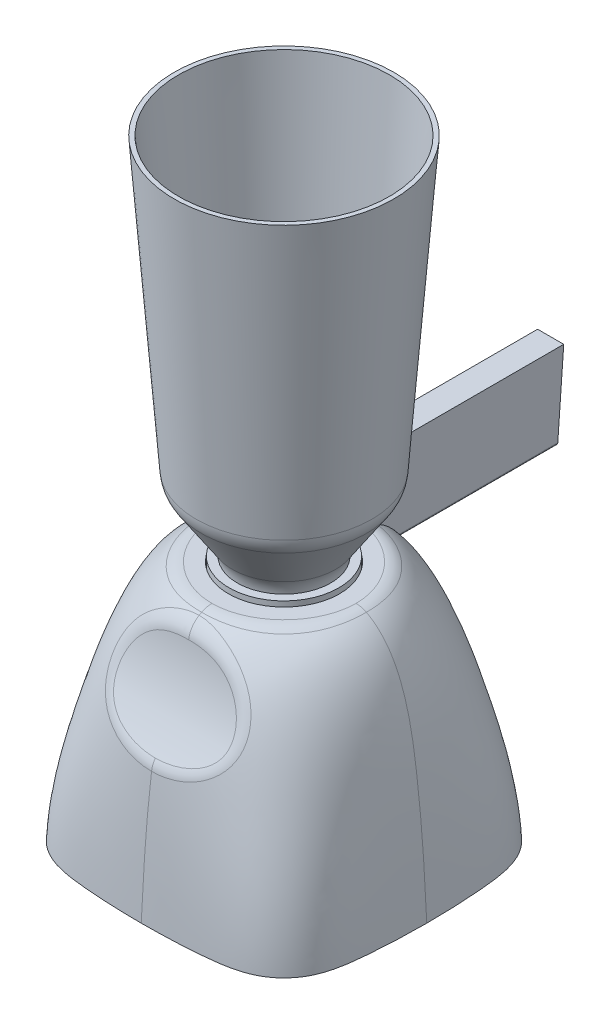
SolidWorks part; units mm, degrees
other "Cup"
other "Base"
ref_plane "Front Plane" through (0, 0, 0) normal (0, 0, 1) x (1, 0, 0)
ref_plane "Top Plane" through (0, 0, 0) normal (0, 1, 0) x (1, 0, 0)
ref_plane "Right Plane" through (0, 0, 0) normal (1, 0, 0) x (0, 0, -1)
ref_plane "Plane1" through (0, 139.7, 0) normal (0, 1, 0) x (1, 0, 0)
sketch "Sketch1" plane through (0, 0, 0) normal (0, 1, 0) x (1, 0, 0)
  line L0 (-74.93, 74.93) -> (74.93, -74.93) construction
  line L1 (-74.93, -74.93) -> (74.93, -74.93) construction
  line L2 (-74.93, -74.93) -> (-74.93, 74.93) construction
  line L3 (-74.93, 74.93) -> (74.93, 74.93) construction
  line L4 (74.93, -74.93) -> (74.93, 74.93) construction
  line L5 (-74.93, 0) -> (74.93, 0) construction
  line L6 (0, 74.93) -> (0, -74.93) construction
  line L7 (11.8724, -82.55) -> (-8.3162, -82.55) construction
  line L8 (82.55, 0.0047) -> (82.55, -0.4308) construction
  spline S0 degree 3 poles (0, -82.55) (11.2435, -82.55) (32.3228, -81.7522) (59.7035, -78.1331) (78.1331, -59.7035) (81.7522, -32.3225) (82.55, -11.2441) (82.55, 0) knots 0 0 0 0 0.238626 0.447515 0.552485 0.761374 1 1 1 1
  point P6 (-34.036, 81.0925)
  point P9 (-34.036, -81.0925)
  point P10 (-62.865, 73.4617)
  point P11 (-73.4617, 62.865)
  point P12 (62.865, 73.4617)
  point P13 (73.4617, 62.865)
  point P14 (73.4617, -62.865)
  point P15 (62.865, -73.4617)
  point P16 (-62.865, -73.4617)
  point P17 (-73.4617, -62.865)
  point P18 (82.55, 0)
  point P19 (0, 82.55)
  point P20 (-82.55, 0)
  point P21 (0, -82.55)
  point P22 (-81.0925, 34.036)
  point P23 (-81.0925, -34.036)
  point P24 (81.0925, 34.036)
  point P25 (34.036, 81.0925)
  point P26 (81.0925, -34.036)
  point P27 (34.036, -81.0925)
  dimension "D1" = 165.1
  dimension "D2" = 7.62
  dimension "D3" = 7.62
  dimension "D4" = 62.865
  dimension "D5" = 14.986
  dimension "D6" = 34.036
  dimension "D7" = 66.548
sketch "Sketch2" plane through (0, 139.7, 0) normal (0, 1, 0) x (1, 0, 0)
  arc A0 (0, -44.45) -> (44.45, 0) centre (0, 0) ccw
  dimension "D1" = 88.9
sketch "Sketch3" plane through (0, 0, 0) normal (1, 0, 0) x (0, 0, -1)
  line L0 (-82.55, 0) -> (-85.0296, -47.3136) construction
  line L1 (-82.55, 0) -> (-82.55, -41.5367) construction
  line L2 (0, 0) -> (0, 139.7) construction
  line L4 (-44.45, 139.7) -> (-11.1167, 153.1675) construction
  line L9 (92.1688, 139.7) -> (-92.1688, 139.7) construction
  spline S0 degree 3 poles (-82.55, 0) (-81.2956, 23.9349) (-78.8068, 68.3395) (-67.603, 130.3456) (-44.45, 139.7) knots 0 0 0 0 0.484738 1 1 1 1
  dimension "D2" = 82.55
  dimension "D1" = 3
  dimension "D3" = 68
  dimension "D4" = 76.835
  dimension "D5" = 71.12
sketch "Sketch4" plane through (0, 0, 0) normal (0, 0, -1) x (-1, 0, 0)
  line L0 (-82.55, 0) -> (-85.0296, -47.3136) construction
  line L1 (-82.55, 0) -> (-82.55, -41.5367) construction
  line L2 (0, 0) -> (0, 139.7) construction
  line L4 (-44.45, 139.7) -> (-11.1167, 153.1675) construction
  spline S0 degree 3 poles (-82.55, 0) (-81.2956, 23.9349) (-78.8068, 68.3395) (-67.603, 130.3456) (-44.45, 139.7) knots 0 0 0 0 0.484738 1 1 1 1
surface "Surface-Extrude1" sketch "Sketch1" parameters "D1"=25.4, "D3"=3
surface "Surface-Extrude2" sketch "Sketch3" parameters "D1"=25.4
surface "Surface-Extrude3" sketch "Sketch4" parameters "D1"=25.4
surface "Surface-Fill1"
mirror "Mirror1" about plane through (0, 0, 0) normal (0, 0, 1)
mirror "Mirror2" about plane through (0, 0, 0) normal (1, 0, 0)
surface "Surface-Plane1"
surface "Surface-Plane2"
surface "Surface-Knit1"
sketch "Sketch5" plane through (0, 0, 0) normal (1, 0, 0) x (0, 0, -1)
  arc A0 (-91.0005, 59.6115) -> (-54.224, 149.4189) centre (-168.3825, 143.7335) ccw
  spline S0 degree 3 poles (-44.45, 139.7) (-67.603, 130.3456) (-78.8068, 68.3395) (-81.2956, 23.9349) (-82.55, 0) knots 0 0 0 0 0.515262 1 1 1 1 construction
  point P3 (-76.1669, 76.2)
  point P5 (-54.5551, 133.35)
  dimension "D3" = 114.3
  dimension "D1" = 76.2
  dimension "D2" = 133.35
extrude "Cut-Extrude1" cut sketch "Sketch5" against normal through all both and the other way through all
fillet "Fillet1" radius 12.7 6 edges at (-36.6926, 102.1358, 61.9207) (36.4493, 96.9547, 64.0933)
shell "Shell1" thickness 2.54
ref_plane "Plane2" through (0, 101.6, 0) normal (0, 1, 0) x (1, 0, 0)
sketch "Sketch6" plane through (0, 101.6, 0) normal (0, 1, 0) x (1, 0, 0)
  line L0 (53.989, 22.86) -> (-51.4868, 22.86)
  line L1 (36.46, -22.86) -> (-69.0158, -22.86)
  line L2 (22.86, 54.8113) -> (22.86, -50.6645)
  line L3 (-22.86, 51.4868) -> (-22.86, -53.989)
  line L4 (22.86, -22.86) -> (-22.86, 22.86) construction
  point P10 (0, 0)
  dimension "D1" = 45.72
  dimension "D2" = 45.72
rib "Rib1" sketch "Sketch6" sketch "Sketch6" thickness 2.54 extrusion direction normal to sketch draft on yes draft angle 3 parameters "D1"=2.54, "D3"=3
delete or keep bodies "Body-Delete/Keep 1" type delete bodies bodies 105 106 107
sketch "Sketch7" plane through (0, 0, 0) normal (0, 0, 1) x (1, 0, 0)
  line L0 (0, 0) -> (0, 384.1191) construction
  line L1 (0, 124.46) -> (-25.4, 124.46)
  line L2 (-25.4, 124.46) -> (-26.9797, 142.5157)
  line L3 (-29.885, 150.8089) -> (-47.827, 177.8)
  line L4 (-50.7483, 186.2873) -> (-63.5, 353.06)
  line L5 (-63.5, 353.06) -> (0, 353.06)
  line L6 (0, 353.06) -> (0, 124.46)
  line L7 (-25.4, 124.46) -> (-25.4, 200.3788) construction
  line L8 (92.1688, 139.7) -> (-92.1688, 139.7) construction
  arc A0 (-26.9797, 142.5157) -> (-29.885, 150.8089) centre (-44.692, 140.9661) ccw
  arc A1 (-47.827, 177.8) -> (-50.7483, 186.2873) centre (-33.02, 187.6428) cw
  point P16 (-27.3749, 147.0328)
  point P17 (-50.3946, 181.6626)
  dimension "D1" = 17.78
  dimension "D2" = 50.8
  dimension "D3" = 127
  dimension "D4" = 5
  dimension "D5" = 228.6
  dimension "D6" = 100.7893
  dimension "D7" = 15.24
  dimension "D8" = 33.613
  dimension "D9" = 53.34
revolve "Revolve1" add sketch "Sketch7" angle 360 about L0
shell "Shell2" thickness 2.54
sketch "Sketch8" plane through (0, 124.46, 0) normal (0, -1, 0) x (1, 0, 0)
  line L0 (0, 0) -> (0, -152.4) construction
  line L1 (-5.7785, -23.1836) -> (5.7785, -23.1836)
  line L2 (-5.7785, -23.1836) -> (-5.7785, -152.4)
  line L3 (-5.7785, -152.4) -> (5.7785, -152.4)
  line L4 (5.7785, -23.1836) -> (5.7785, -152.4)
  circle A1 centre (0, 0) radius 23.1836 construction
  dimension "D1" = 11.557
  dimension "D2" = 152.4
extrude "Boss-Extrude1" add sketch "Sketch8" against normal blind 50.8 draft 2 separate body
other "Intersect1"
sketch "Sketch9" plane through (0, 0, 0) normal (0, 0, 1) x (1, 0, 0)
  line L1 (0, 124.46) -> (0, 142.5157) construction
  line L2 (-25.4, 124.46) -> (25.4, 124.46) construction
  line L3 (26.9797, 142.5157) -> (-26.9797, 142.5157) construction
  line L6 (0, 124.46) -> (-31.75, 124.46)
  line L7 (0, 124.46) -> (0, 142.5157)
  line L8 (0, 142.5157) -> (-31.75, 142.5157)
  line L9 (-31.75, 124.46) -> (-31.75, 142.5157)
  dimension "D1" = 63.5
revolve "Revolve2" add sketch "Sketch9" angle 360 about L1
sketch "Sketch10" plane through (0, 124.46, 0) normal (0, -1, 0) x (1, 0, 0)
  circle A0 centre (0, 0) radius 12.7
  dimension "D1" = 25.4
extrude "Cut-Extrude2" cut sketch "Sketch10" against normal blind 12.7 draft 3
fillet "Fillet2" radius 6.35 2 edges at (6.0941, 133.4968, -31.1597) (-6.0941, 133.4968, -31.1597)
fillet "Fillet3" radius 1.5875 7 edges at (10.3734, 133.5015, -30.0076) (-6.7891, 124.46, -32.6825) (7.17, 124.46, -32.1527) (5.7785, 124.46, -94.2596) (-5.7785, 124.46, -94.2596) (-6.0942, 133.5015, -36.0118) (0, 124.46, 31.75)
other "Indent1" parameters "D1"=2.54, "D2"=0.381
